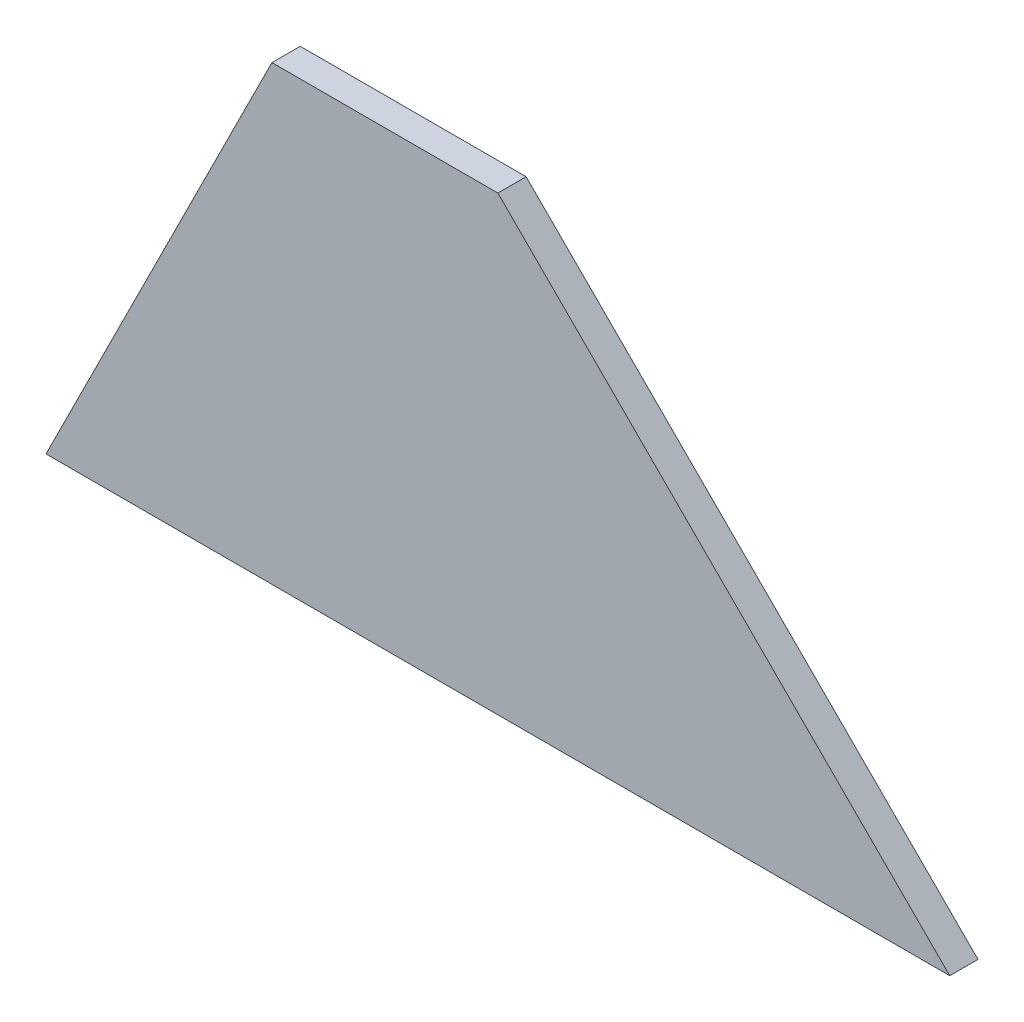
SolidWorks part; units mm, degrees
ref_plane "Front Plane" through (0, 0, 0) normal (0, 0, 1) x (1, 0, 0)
ref_plane "Top Plane" through (0, 0, 0) normal (0, 1, 0) x (1, 0, 0)
ref_plane "Right Plane" through (0, 0, 0) normal (1, 0, 0) x (0, 0, -1)
sketch "Sketch1" plane through (0, 0, 0) normal (0, 0, 1) x (1, 0, 0)
  line L0 (0, 0) -> (-33.8667, 0)
  line L1 (-33.8667, 0) -> (-25.4, 16.9333)
  line L2 (-16.9333, -6.0809) -> (-16.9333, 24.4548) construction
  line L3 (-25.4, -6.0809) -> (-25.4, 24.4548) construction
  line L4 (-16.9333, 16.9333) -> (-25.4, 16.9333)
  line L5 (-16.9333, 16.9333) -> (0, 0)
  dimension "D1" = 33.8667
  dimension "D2" = 8.4667
  dimension "D4" = 8.4667
extrude "Extrude1" add sketch "Sketch1" along normal blind 1.0583
